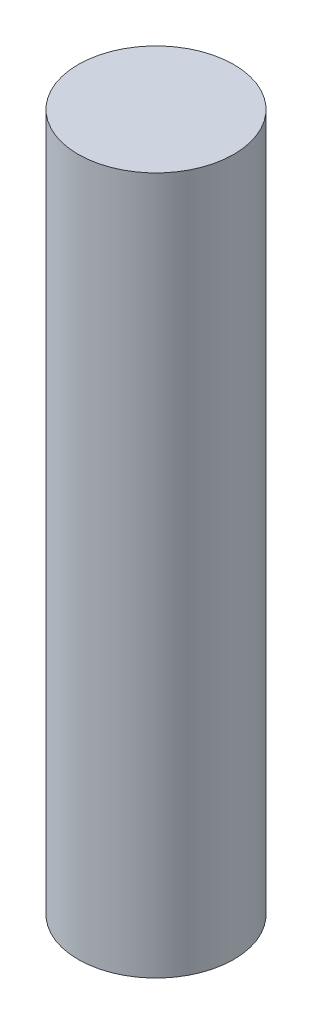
SolidWorks part; units mm, degrees
ref_plane "Front Plane" through (0, 0, 0) normal (0, 0, 1) x (1, 0, 0)
ref_plane "Top Plane" through (0, 0, 0) normal (0, 1, 0) x (1, 0, 0)
ref_plane "Right Plane" through (0, 0, 0) normal (1, 0, 0) x (0, 0, -1)
sketch "Sketch1" plane through (0, 0, 0) normal (0, 1, 0) x (1, 0, 0)
  circle A0 centre (0, 0) radius 0.7937
  dimension "D1" = 1.5875
extrude "Boss-Extrude1" add sketch "Sketch1" along normal blind 7.112
